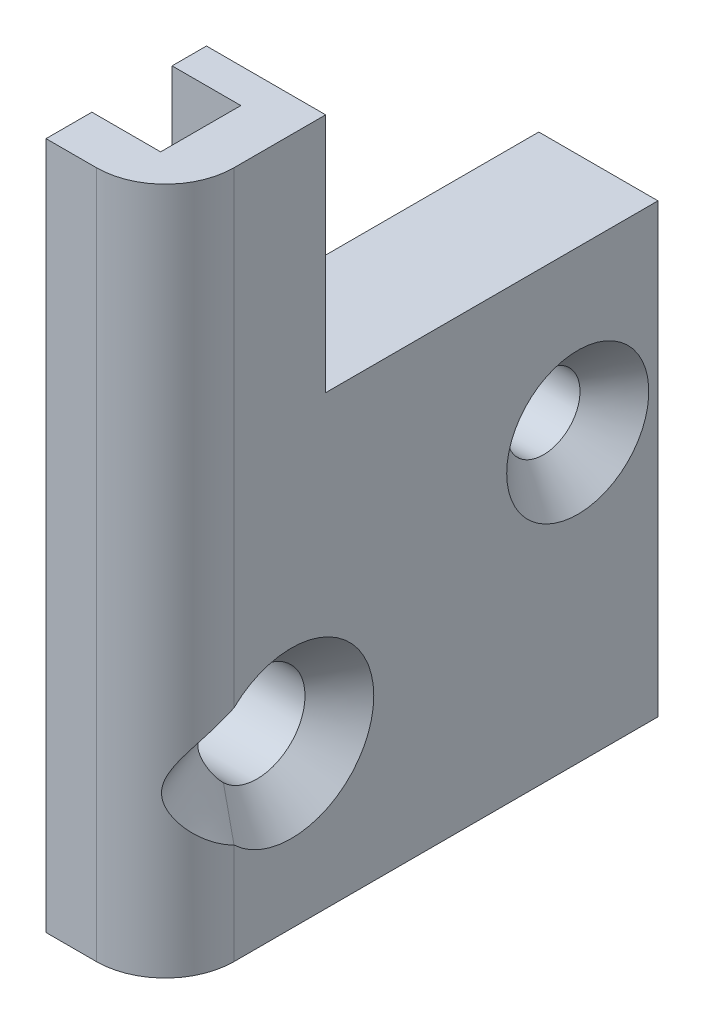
SolidWorks part; units mm, degrees
ref_plane "Plano frontal" through (0, 0, 0) normal (0, 0, 1) x (1, 0, 0)
ref_plane "Plano superior" through (0, 0, 0) normal (0, 1, 0) x (1, 0, 0)
ref_plane "Plano direito" through (0, 0, 0) normal (1, 0, 0) x (0, 0, -1)
sketch "Esboço1" plane through (0, 0, 0) normal (1, 0, 0) x (0, 0, -1)
  line L0 (0, 0) -> (-21.5, 0)
  line L1 (-21.5, 0) -> (-21.5, 30)
  line L2 (-21.5, 30) -> (-14.5, 30)
  line L3 (-14.5, 30) -> (-14.5, 19.5)
  line L4 (-14.5, 19.5) -> (0, 19.5)
  line L5 (0, 19.5) -> (0, 0)
  dimension "D1" = 19.5
  dimension "D2" = 30
  dimension "D3" = 7
  dimension "D4" = 14.5
extrude "Ressalto-extrusão1" add sketch "Esboço1" along normal blind 5.2
sketch "Esboço2" plane through (0, 0, 0) normal (-1, 0, 0) x (0, 0, 1)
  line L0 (16, 30) -> (16, 19)
  line L1 (14.5, 30) -> (21.5, 30) construction
  line L4 (8.7002, 2.4899) -> (16, 14)
  line L5 (16, 14) -> (19.5, 14)
  line L6 (19.5, 14) -> (19.5, 30)
  line L7 (19.5, 30) -> (16, 30)
  line L8 (2.1752, 8.4812) -> (16, 19)
  line L12 (21.5, 30) -> (21.5, 0) construction
  line L13 (21.5, 0) -> (0, 0) construction
  line L15 (0.4, 4.9) -> (0.4, 14.5229) construction
  line L16 (0, 0) -> (0, 19.5) construction
  line L17 (0.4, 4.9) -> (12.8809, 4.9) construction
  arc A1 (2.1752, 8.4812) -> (8.7002, 2.4899) centre (4.9, 4.9) ccw
  point P4 (4.9, 0.4)
  dimension "D1" = 16
  dimension "D4" = 4.5
  dimension "D6" = 0.4
  dimension "D2" = 3.5
  dimension "D3" = 5
  dimension "D5" = 0.4
  dimension "D7" = 2
extrude "Corte-extrusão1" cut sketch "Esboço2" against normal blind 3
fillet "Filete1" radius 3 2 edges at (1.5, 19, 16) (1.5, 14, 19.5)
sketch "Esboço3" plane through (3, 0, 0) normal (-1, 0, 0) x (0, 0, 1)
  line L0 (8.7002, 2.4899) -> (16, 14) construction
  line L2 (8.7002, 2.4899) -> (14.9288, 12.311)
  line L4 (10.7183, 14.9814) -> (14.9288, 12.311)
  line L5 (14.8166, 18.0996) -> (2.1752, 8.4812) construction
  line L6 (2.1752, 8.4812) -> (10.7183, 14.9814)
  arc A1 (2.1752, 8.4812) -> (8.7002, 2.4899) centre (4.9, 4.9) ccw construction
  arc A3 (2.1752, 8.4812) -> (8.7002, 2.4899) centre (4.9, 4.9) ccw
  dimension "D1" = 2
extrude "Corte-extrusão2" cut sketch "Esboço3" against normal blind 1.3
fillet "Fillet1" radius 20 1 edges at (1.5, 14, 16)
chamfer "Chanfro1" distance 1.5 angle 60 2 edges at (3, 13.5293, 13.0078) (4.3, 13.5293, 13.0078)
sketch "Esboço4" plane through (5.2, 0, 0) normal (1, 0, 0) x (0, 0, -1)
  line L0 (0, 0) -> (0, 19.5) construction
  line L1 (-21.5, 0) -> (0, 0) construction
  circle A0 centre (-16, 7) radius 2.1
  circle A1 centre (-3.5, 12.5) radius 1.6
  dimension "D1" = 3.2
  dimension "D2" = 3.5
  dimension "D3" = 16
  dimension "D4" = 7
  dimension "D5" = 12.5
  dimension "D6" = 4.2
extrude "Corte-extrusão3" cut sketch "Esboço4" against normal up to next
fillet "Filete2" radius 3 1 edges at (5.2, 15, 21.5)
chamfer "Chamfer1" distance 1.5 angle 45 2 edges at (5.2, 12.5, 1.9) (5.2, 7, 13.9)
